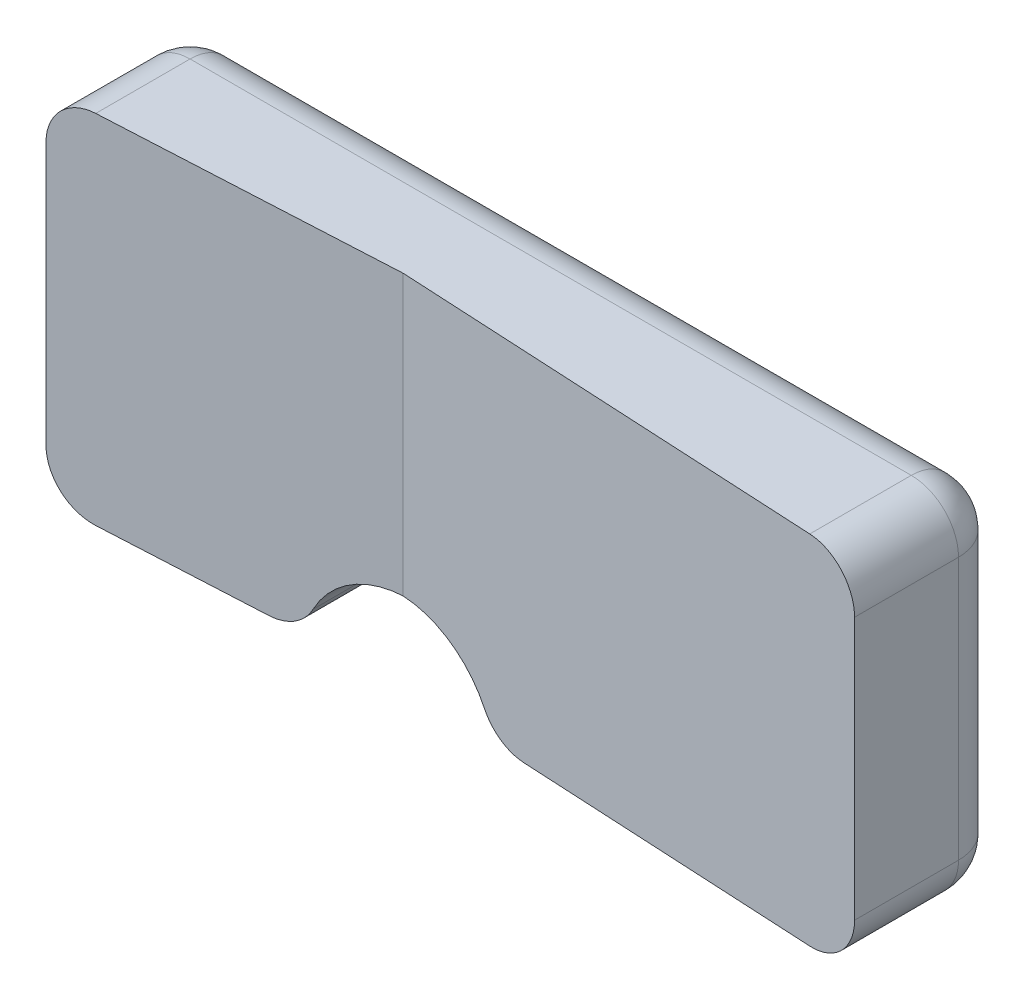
SolidWorks part; units mm, degrees
ref_plane "Front" through (0, 0, 0) normal (0, 0, 1) x (1, 0, 0)
ref_plane "Top" through (0, 0, 0) normal (0, 1, 0) x (1, 0, 0)
ref_plane "Right" through (0, 0, 0) normal (1, 0, 0) x (0, 0, -1)
sketch "Sketch1" plane through (0, 0, 0) normal (0, 0, 1) x (1, 0, 0)
  line L0 (0, 0) -> (0, 76.6753) construction
  line L1 (-57, 25.4) -> (80, 25.4)
  line L2 (-57, 25.4) -> (-57, -34.544)
  line L3 (-57, -34.544) -> (80, -34.544)
  line L4 (80, 25.4) -> (80, -34.544)
  line L5 (0, 0) -> (108.0424, 0) construction
  dimension "D1" = 57
  dimension "D2" = 80
  dimension "D3" = 59.944
  dimension "D4" = 25.4
extrude "Extrude1" add sketch "Sketch1" along normal blind 19.05 and the other way blind 10
sketch "Sketch2" plane through (0, 25.4, 0) normal (0, 1, 0) x (-1, 0, 0)
  line L0 (-80, 15.4) -> (0, 11.2074)
  line L1 (-80, 19.05) -> (-80, -10) construction
  line L2 (0, 11.2074) -> (57, 14.1946)
  line L3 (-80, 15.4) -> (-80, 40.7527)
  line L4 (-50.0692, 40.7423) -> (-97.3912, 40.7587) construction
  line L5 (-80, 40.7527) -> (57, 40.7527)
  line L6 (57, 14.1946) -> (57, 40.7527)
  line L7 (57, 19.05) -> (57, -10) construction
  line L8 (57, -10) -> (-80, -10) construction
  dimension "D1" = 87
  dimension "D2" = 87
  dimension "D3" = 25.4
extrude "Cut-Extrude2" cut sketch "Sketch2" against normal blind 108.458
sketch "Sketch3" plane through (0, 0, -10) normal (0, 0, -1) x (-1, 0, 0)
  line L0 (-15.875, -34.544) -> (15.875, -34.544)
  line L1 (57, -34.544) -> (-80, -34.544) construction
  line L9 (-2.3912, -52.1143) -> (-2.3912, 5.7796) construction
  line L10 (-2.3912, -26.406) -> (-2.3912, -29.406) construction
  arc A0 (-15.875, -34.544) -> (15.875, -34.544) centre (0, -37.7371) cw
  point P7 (-19.0267, -30.0638)
  point P8 (0, -21.5441)
  dimension "D2" = 31.75
  dimension "D3" = 21.5441
  dimension "D4" = 16.1929
  dimension "D1" = 2.3912
extrude "Cut-Extrude3" cut sketch "Sketch3" against normal blind 25.6411
fillet "Fillet1" [suppressed] radius 3.175
fillet "Fillet4" radius 7.9375 12 edges at (-57, -34.544, 2.0973) (-36.4375, -34.544, -10) (-57, -4.572, -10) (-57, 25.4, 2.0973) (11.5, 25.4, -10) (47.9375, -34.544, -10) (80, -34.544, 2.7) (80, -4.572, -10) (80, 25.4, 2.7) (-15.875, -34.544, 1.0197) (0, -21.5441, -10) (15.875, -34.544, 1.0197)
